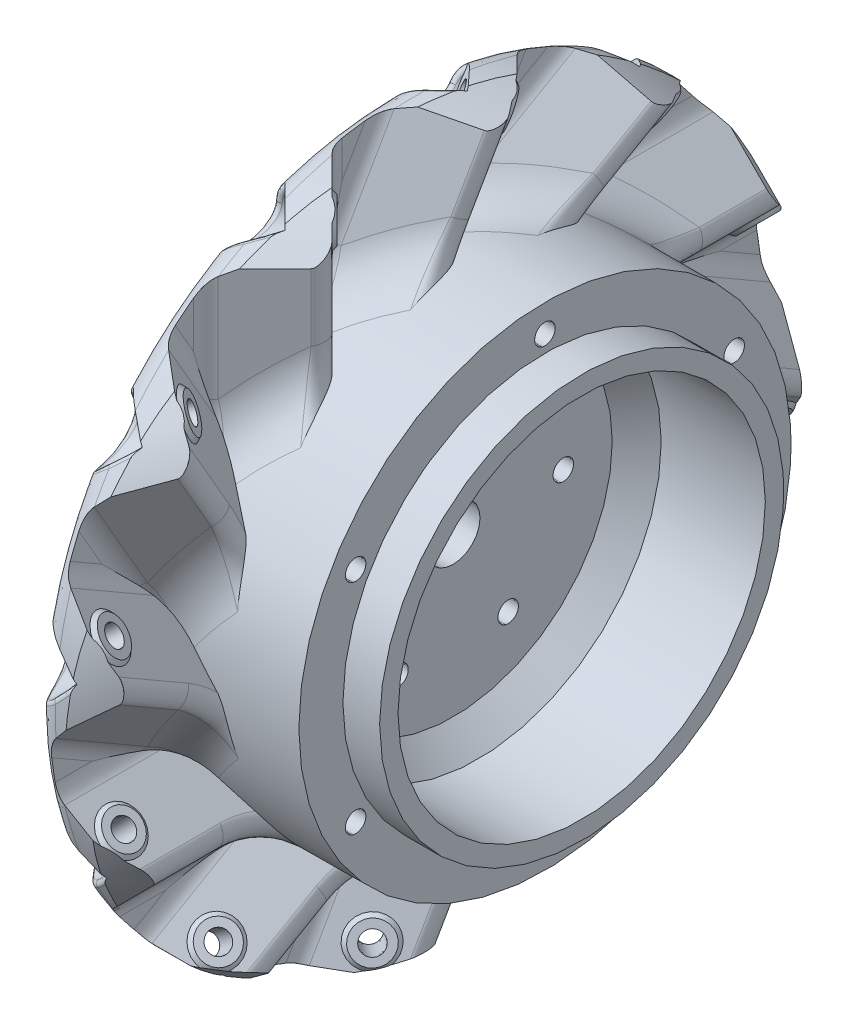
SolidWorks part; units mm, degrees
other "Volumenkörper1[1]"
ref_plane "Alzado" through (0, 0, 0) normal (0, 0, 1) x (1, 0, 0)
ref_plane "Planta" through (0, 0, 0) normal (0, 1, 0) x (1, 0, 0)
ref_plane "Vista lateral" through (0, 0, 0) normal (1, 0, 0) x (0, 0, -1)
imported_body "omniWheel2_B.stp<1>"
scale "Escala1" scale about centroid uniform scaling yes scale factor 0.75
sketch "Croquis2" plane through (-29.8742, 0, 29.8742) normal (-0.7071, 0, 0.7071) x (0.7071, 0, 0.7071)
  circle A0 centre (-4.7485, 64.7387) radius 2.15
  dimension "D1" = 4.3
extrude "BarrenoEjeRodillo" cut sketch "Croquis2" against normal blind 10
pattern_circular "MatrizEjeRodillo" count 12 over 360 about axis through (-30.5881, 0, 0) along (-1, 0, 0) of "BarrenoEjeRodillo"
sketch "Croquis3" plane through (-38.0881, 0, 0) normal (-1, 0, 0) x (0, 0, 1)
  circle A0 centre (11.25, 19.4856) radius 2.1
  circle A1 centre (22.5, 0) radius 2.1
  circle A2 centre (11.25, -19.4856) radius 2.1
  circle A3 centre (-11.25, -19.4856) radius 2.1
  circle A4 centre (-22.5, 0) radius 2.1
  circle A5 centre (-11.25, 19.4856) radius 2.1
  circle A6 centre (0, 44.625) radius 2.1
  circle A7 centre (0, 44.625) radius 2.0625 construction
  circle A8 centre (38.6464, 22.3125) radius 2.1
  circle A9 centre (38.6464, -22.3125) radius 2.1
  circle A10 centre (0, -44.625) radius 2.1
  circle A11 centre (-38.6464, -22.3125) radius 2.1
  circle A12 centre (-38.6464, 22.3125) radius 2.1
  point P15 (0, 0)
  point P32 (0, 0)
  dimension "D1" = 4.2
  dimension "D3" = 4.2
  dimension "D4" = 6
  dimension "D2" = 6
extrude "BarrenoTornillosEnsamble" cut sketch "Croquis3" against normal through all
sketch "Croquis4" plane through (-25.4655, 0, 0) normal (1, 0, 0) x (0, 0, -1)
  circle A0 centre (0, 0) radius 5.5
  circle A2 centre (0, 0) radius 15
  dimension "D1" = 11
  dimension "D3" = 30
extrude "RellenoCentral" add sketch "Croquis4" against normal up to surface (12.6227 mm away)
sketch "Croquis5" plane through (-38.0881, 0, 0) normal (-1, 0, 0) x (0, 0, 1)
  circle A0 centre (0, 0) radius 11.1
  dimension "D1" = 22.2
extrude "CorteBalero" cut sketch "Croquis5" against normal blind 6.3
chamfer "Chaflán1" distance 5 angle 45 1 edges at (-25.4655, 0, 37.5)
fillet "Redondeo8" radius 3 13 edges
fillet "Redondeo4" radius 5 24 edges
fillet "Redondeo5" radius 0.8 50 edges
